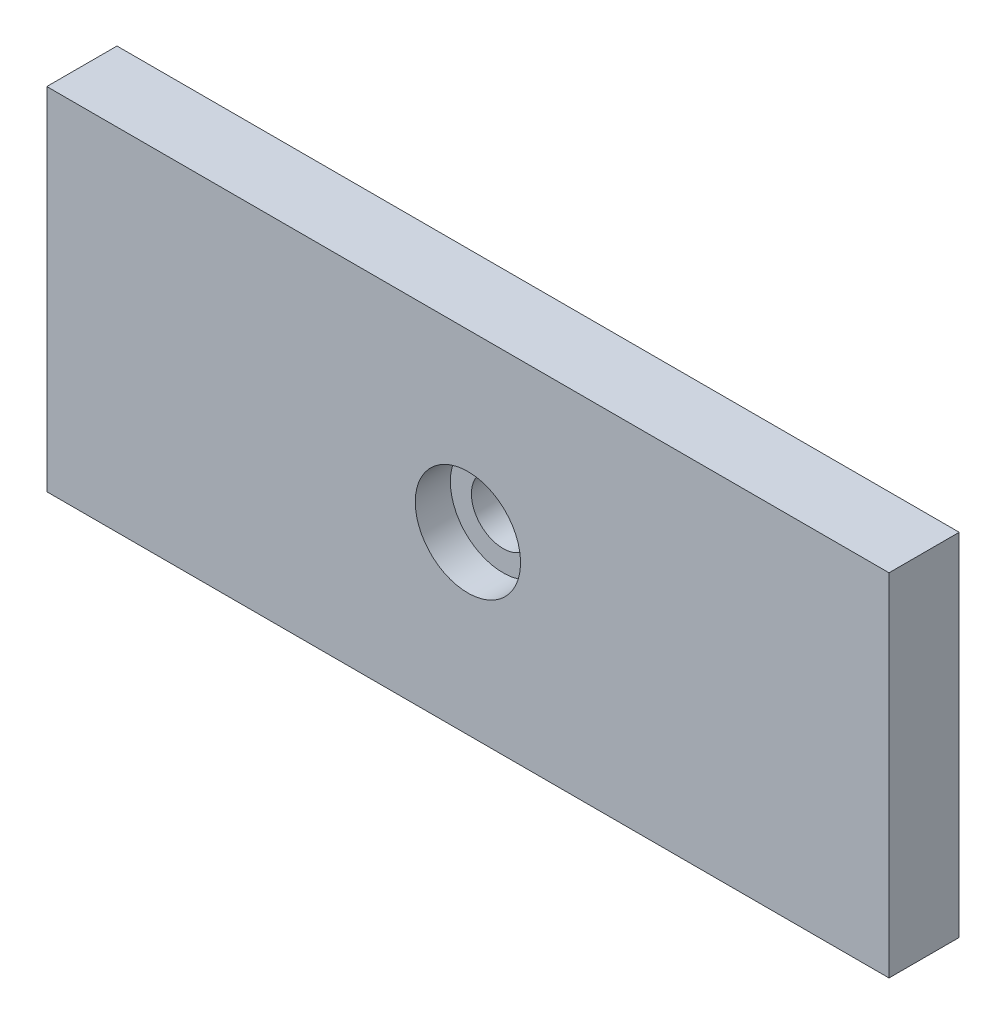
SolidWorks part; units mm, degrees
ref_plane "Face" through (0, 0, 0) normal (0, 0, 1) x (1, 0, 0)
ref_plane "Dessus" through (0, 0, 0) normal (0, 1, 0) x (1, 0, 0)
ref_plane "Droite" through (0, 0, 0) normal (1, 0, 0) x (0, 0, -1)
mirrored part "plaque intermédiaire_Rendre symétrique"
other "<plaque intermédiaire>-<Chambrage pour vis à tête cylindrique fendue M82>"
